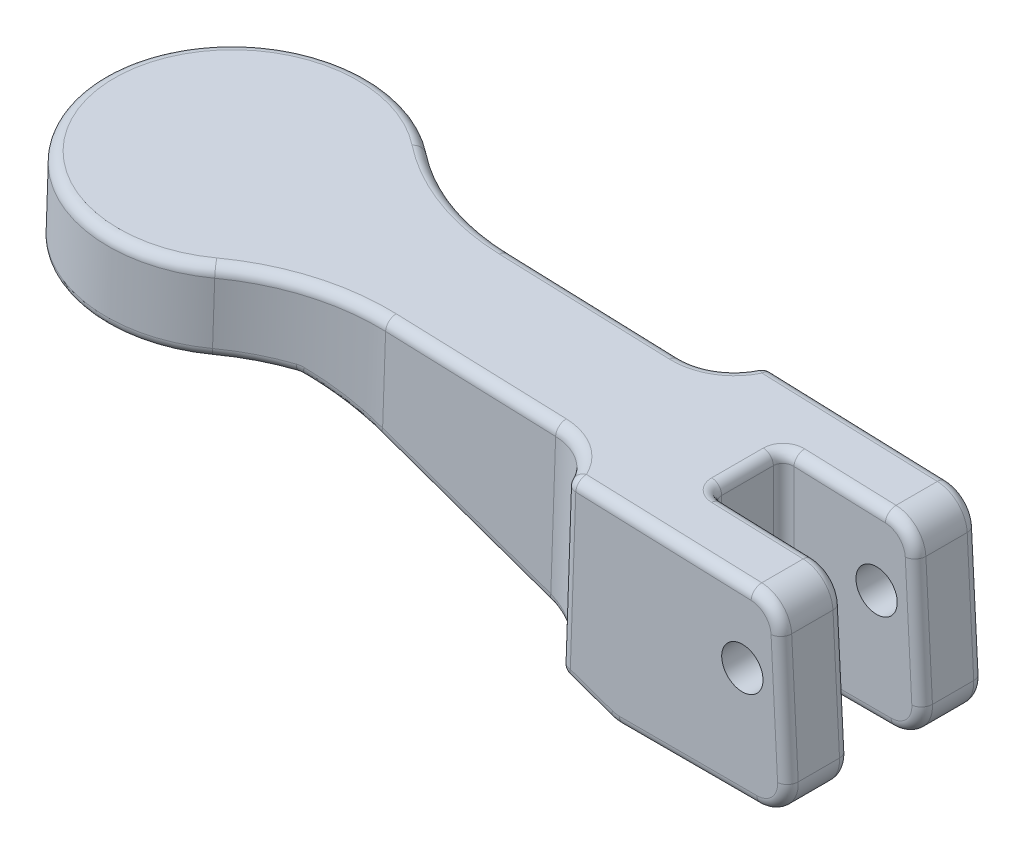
SolidWorks part; units mm, degrees
ref_plane "Front Plane" through (0, 0, 0) normal (0, 0, 1) x (1, 0, 0)
ref_plane "Top Plane" through (0, 0, 0) normal (0, 1, 0) x (1, 0, 0)
ref_plane "Right Plane" through (0, 0, 0) normal (1, 0, 0) x (0, 0, -1)
sketch "Sketch1" plane through (0, 0, 0) normal (0, 0, 1) x (1, 0, 0)
  line L0 (3.6331, 7) -> (-71.3212, 9.6175)
  line L1 (-71.3212, 9.6175) -> (-71.6004, 1.6223)
  line L2 (-71.6004, 1.6223) -> (-45.6162, 0.7149)
  line L3 (-12.4235, -11) -> (4.5765, -11)
  line L4 (4.5765, -11) -> (3.6331, 7)
  line L5 (-45.6162, 0.7149) -> (-12.4235, -11)
  line L6 (0, 0) -> (0, -11) construction
  line L7 (0, 0) -> (4, 0) construction
  line L8 (3.6331, 7) -> (3.6331, -11) construction
  dimension "D1" = 18
  dimension "D2" = 8
  dimension "D3" = 26
  dimension "D4" = 75
  dimension "D5" = 4
  dimension "D6" = 11
  dimension "D7" = 17
  dimension "D8" = 3
  dimension "D9" = 95
extrude "Boss-Extrude1" add sketch "Sketch1" along normal mid plane 26
sketch "Sketch2" plane through (0.2486, 7.1182, 0) normal (0.0349, 0.9994, 0) x (0.9994, -0.0349, 0)
  line L0 (3.3866, 0) -> (-71.6134, 0) construction
  line L1 (4.9576, 9.5) -> (-17.0424, 9.5)
  line L2 (-47.0808, 6) -> (-17.0424, 6)
  line L3 (-17.0424, 6) -> (-17.0424, 9.5)
  line L4 (-58.6134, 0) -> (0, 0) construction
  line L5 (4.9576, 9.5) -> (4.9576, -9.5)
  line L6 (4.9576, -9.5) -> (-17.0424, -9.5)
  line L7 (-17.0424, -6) -> (-17.0424, -9.5)
  line L8 (-47.0808, -6) -> (-17.0424, -6)
  arc A0 (-47.0808, 6) -> (-47.0808, -6) centre (-58.6134, 0) ccw
  point P14 (4.9576, 0)
  dimension "D1" = 26
  dimension "D2" = 22
  dimension "D3" = 19
  dimension "D4" = 12
extrude "Cut-Extrude1" cut sketch "Sketch2" against normal through all flip side to cut
sketch "Sketch4" plane through (0, 0, 0) normal (0, 0, 1) x (1, 0, 0)
  circle A0 centre (0, 0) radius 2
  dimension "D1" = 4
extrude "Cut-Extrude3" cut sketch "Sketch4" against normal through all and the other way through all
fillet "Fillet1" radius 20 2 edges at (-46.9431, 4.7637, -6) (-46.9431, 4.7637, 6)
fillet "Fillet2" radius 5 2 edges at (-17.0797, -0.7696, -6) (-17.0797, -0.7696, 6)
fillet "Fillet3" radius 3 3 edges at (-12.4235, -11, 0) (4.5765, -11, 0) (3.6331, 7, 0)
sketch "Sketch3" plane through (0, 0, 0) normal (0, 1, 0) x (1, 0, 0)
  line L0 (0, 0) -> (-9, 0) construction
  line L1 (4.5765, 3.5) -> (-9, 3.5)
  line L2 (4.5765, 3.5) -> (4.5765, -3.5)
  line L3 (4.5765, -3.5) -> (-9, -3.5)
  line L4 (-9, 3.5) -> (-9, -3.5)
  dimension "D1" = 7
  dimension "D2" = 9
extrude "Cut-Extrude2" cut sketch "Sketch3" against normal through all and the other way through all
fillet "Fillet4" radius 1 47 edges at (-71.6004, 1.6223, 0) (-9, -11, 0) (-48.2148, 0.8057, -8.6351) (-48.2148, 0.8057, 8.6351) (-12.4161, -10.9569, 9.5) (-5.2472, -11, 9.5) (3.5913, -10.0651, 9.5) (4.094, -1.7941, 9.5) (2.8839, 6.2375, 9.5) (-12.4161, -10.9569, -9.5) (-5.2472, -11, -9.5) (3.5913, -10.0651, -9.5) (4.094, -1.7941, -9.5) (2.8839, 6.2375, -9.5) (-3.7924, -11, -3.5) (3.5913, -10.0651, -3.5) (4.094, -1.7941, -3.5) (2.8839, 6.2375, -3.5) (-3.7924, -11, 3.5) (3.5913, -10.0651, 3.5) (4.094, -1.7941, 3.5) (2.8839, 6.2375, 3.5) (-19.1666, -8.6201, -6.9689) (-30.2345, -4.7138, -6) (-42.0619, -0.5395, -6.3502) (-45.6162, 0.7149, 0) (-42.0619, -0.5395, 6.3502) (-30.2345, -4.7138, 6) (-19.1666, -8.6201, 6.9689) (-15.142, -10.0405, 9.5) (-15.142, -10.0405, -9.5) (-7.9488, 7.4045, 9.5) (-18.594, 7.7762, 6.9689) (-29.7847, 8.167, 6) (-44.5285, 8.6818, 7.0903) (-71.3212, 9.6175, 0) (-44.5285, 8.6818, -7.0903) (-29.7847, 8.167, -6) (-18.594, 7.7762, -6.9689) (-7.9488, 7.4045, -9.5) (-4.0571, 7.2685, -3.5) (-9, 7.4412, 0) (-4.0571, 7.2685, 3.5) (-9, -1.7794, 3.5) (-9, -1.7794, -3.5) (-17.0797, -0.7696, -9.5) (-17.0797, -0.7696, 9.5)
